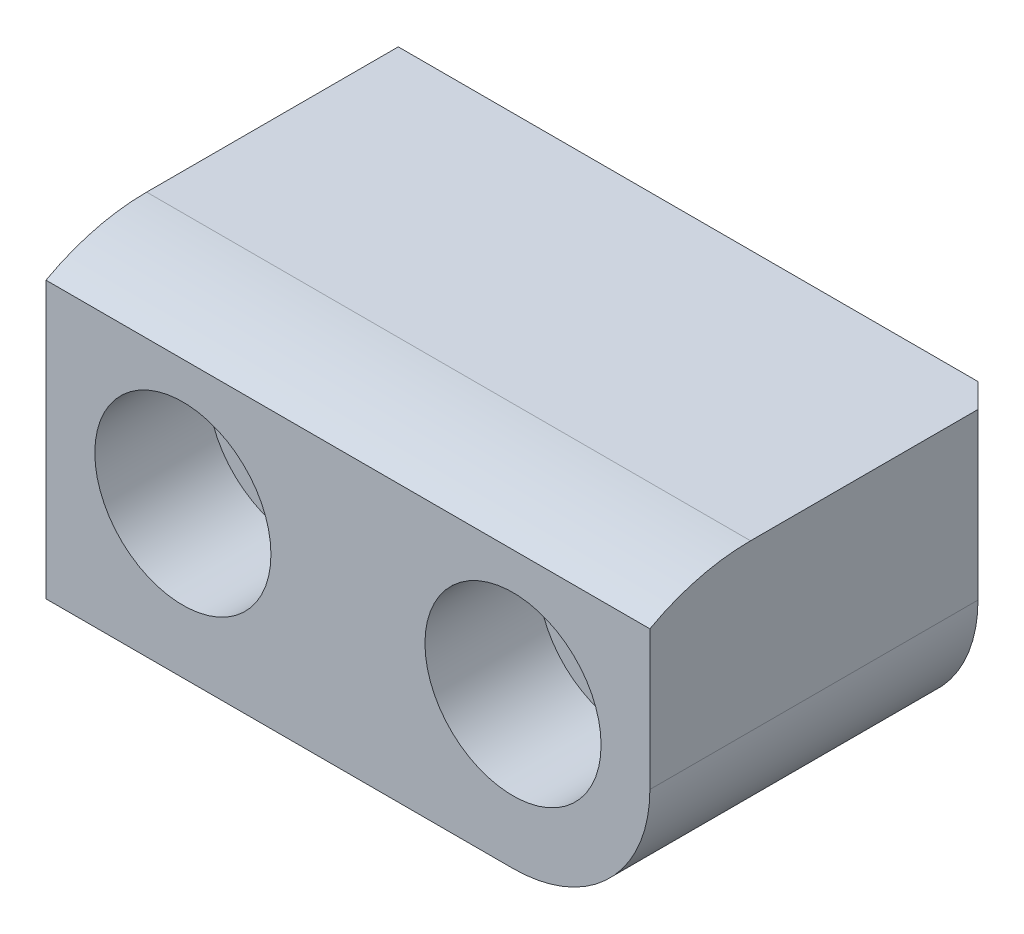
SolidWorks part; units mm, degrees
ref_plane "Front Plane" through (0, 0, 0) normal (0, 0, 1) x (1, 0, 0)
ref_plane "Top Plane" through (0, 0, 0) normal (0, 1, 0) x (1, 0, 0)
ref_plane "Right Plane" through (0, 0, 0) normal (1, 0, 0) x (0, 0, -1)
sketch "Sketch3" plane through (0, 0, 0) normal (0, 0, 1) x (1, 0, 0)
  line L0 (0, -10.4775) -> (0, 10.4775) construction
  line L1 (0, 0) -> (38.1, 0)
  line L2 (0, 0) -> (0, -19.05)
  line L3 (0, -19.05) -> (38.1, -19.05)
  line L4 (38.1, 0) -> (38.1, -19.05)
  dimension "D1" = 19.05
  dimension "D2" = 38.1
extrude "Extrude1" add sketch "Sketch3" against normal blind 22.225
fillet "Fillet1" radius 8.636 1 edges at (38.1, -19.05, -11.1125)
hole_wizard "1/4\"-20 CBORE" positions "Sketch5" profile "Sketch4" counterbore size "1/4" standard "Ansi Inch"
sketch "Sketch5" plane through (0, 0, 0) normal (0, 0, 1) x (1, 0, 0)
  line L0 (-1.269, -9.525) -> (49998.731, -9.525) construction
  line L1 (38.1, 0) -> (0, 0) construction
  line L2 (0, -19.05) -> (29.464, -19.05) construction
  line L3 (0, 0) -> (0, -19.05) construction
  line L5 (38.1, -10.414) -> (38.1, 0) construction
  point P0 (8.636, -9.525)
  point P1 (29.464, -9.525)
  dimension "D1" = 8.636
  dimension "D2" = 8.636
sketch "Sketch4" plane through (8.636, -9.525, 0) normal (1, 0, 0) x (0, -1, 0)
  line L0 (0, 0) -> (0, 22.225)
  line L1 (0, 22.225) -> (3.2639, 22.225)
  line L3 (3.2639, 22.225) -> (3.2639, 7.1438)
  line L4 (3.2639, 7.1438) -> (5.5562, 7.1437)
  line L5 (5.5562, 7.1437) -> (5.5562, 0)
  line L7 (5.5562, 0) -> (0, 0)
  line L11 (0, -6.35) -> (0, 107.95) construction
  dimension "Thru Hole Dia." = 6.5278
  dimension "Thru Hole Depth" = 22.225
  dimension "C'Bore Dia." = 11.1125
  dimension "C'Bore Depth" = 7.1437
sketch "Sketch6" plane through (0, 0, 0) normal (-1, 0, 0) x (0, 0, 1)
  line L0 (-6.35, 0) -> (-6.35, 5.08)
  line L1 (0, -1.6366) -> (6.35, -1.6366)
  line L4 (0, 0) -> (0, -19.05) construction
  line L5 (-22.225, 0) -> (0, 0) construction
  line L6 (-6.35, 5.08) -> (6.35, 5.08)
  line L7 (6.35, 5.08) -> (6.35, -1.6366)
  arc A0 (0, -1.6366) -> (-0.5292, -0.9111) centre (-0.762, -1.6366) ccw construction
  arc A1 (-6.35, 0) -> (0, -1.6366) centre (-6.35, -13.137) cw
  arc A2 (-0.5292, -0.9111) -> (-6.35, 0) centre (-6.35, -19.05) ccw construction
  dimension "D1" = 19.05
  dimension "D2" = 0.762
  dimension "D3" = 6.35
  dimension "D4" = 5.08
  dimension "D5" = 12.7
extrude "Cut-Extrude1" cut sketch "Sketch6" against normal through all
chamfer "Chamfer1" distance 1.524 angle 45 3 edges at (14.732, -19.05, -22.225) (35.5706, -16.5206, -22.225) (38.1, -5.207, -22.225)
